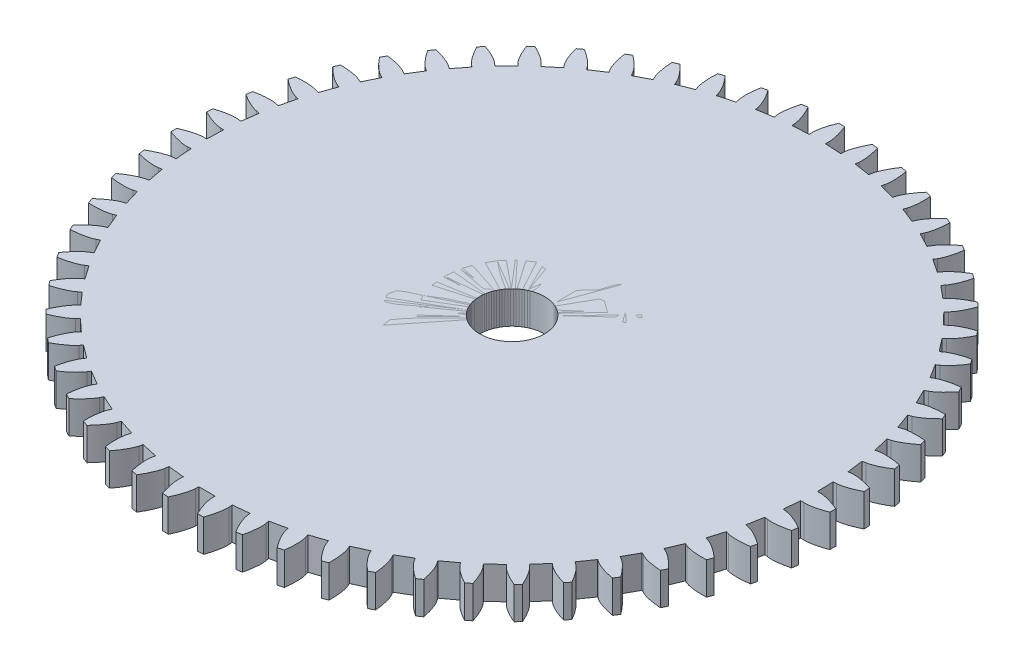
SolidWorks part; units mm, degrees
ref_plane "Front Plane" through (0, 0, 0) normal (0, 0, 1) x (1, 0, 0)
ref_plane "Top Plane" through (0, 0, 0) normal (0, 1, 0) x (1, 0, 0)
ref_plane "Right Plane" through (0, 0, 0) normal (1, 0, 0) x (0, 0, -1)
sketch "Sketch1" plane through (0, 0, 0) normal (0, 1, 0) x (1, 0, 0)
  line L0 (0, 0) -> (0, 14.2802) construction
  line L1 (0, 0) -> (-14.2802, 0) construction
  line L2 (0, 0) -> (-15.2446, -0.406) construction
  line L3 (0, 0) -> (-14.2599, -0.76) construction
  line L4 (0, 0) -> (-14.1993, -1.5179) construction
  circle A0 centre (0, 0) radius 14.75 construction
  circle A1 centre (0, 0) radius 14.2802 construction
  circle A2 centre (0, 0) radius 14.125 construction
  circle A3 centre (0, 0) radius 15.25 construction
  spline S0 degree 4 poles (-14.2802, 0) (-14.2978, 0) (-14.3474, -0.0018) (-14.4406, -0.0124) (-14.5913, -0.0399) (-14.7805, -0.0895) (-15.0205, -0.1702) (-15.2961, -0.2862) (-15.59, -0.435) (-15.8988, -0.619) (-16.1959, -0.8219) (-16.4812, -1.041) (-16.7546, -1.2747) (-17.0723, -1.574) (-17.4337, -1.9569) (-17.8253, -2.4333) (-18.2313, -3.0115) (-18.6013, -3.6289) (-18.9288, -4.2696) (-19.2147, -4.9301) (-19.4294, -5.5215) (-19.5889, -6.0376) (-19.7289, -6.5574) (-19.8297, -6.9976) (-19.9148, -7.4353) (-19.9848, -7.8848) (-20.0314, -8.232) (-20.0699, -8.6068) (-20.098, -8.9343) (-20.1241, -9.4189) (-20.1316, -9.7093) (-20.1356, -10.1755) (-20.1272, -10.3827) (-20.1236, -10.571) (-20.1201, -10.6259) (-20.1186, -10.6664) (-20.1179, -10.6883) knots 0 0 0 0 0 0.005377 0.015084 0.028532 0.04661 0.064855 0.092111 0.119476 0.146842 0.174209 0.201575 0.228941 0.256307 0.307035 0.361767 0.4165 0.471232 0.525964 0.580697 0.635429 0.662795 0.690161 0.744894 0.77226 0.799626 0.826992 0.854358 0.881725 0.909091 0.954545 0.977273 0.988636 0.994318 1 1 1 1 1 construction
  spline S1 degree 4 poles (-14.2802, 0) (-14.2978, 0) (-14.3474, -0.0018) (-14.4406, -0.0124) (-14.5913, -0.0399) (-14.7805, -0.0895) (-15.0205, -0.1702) (-15.2961, -0.2862) (-15.59, -0.435) (-15.8988, -0.619) (-16.1959, -0.8219) (-16.4812, -1.041) (-16.7546, -1.2747) (-17.0723, -1.574) (-17.4337, -1.9569) (-17.8253, -2.4333) (-18.2313, -3.0115) (-18.6013, -3.6289) (-18.9288, -4.2696) (-19.2147, -4.9301) (-19.4294, -5.5215) (-19.5889, -6.0376) (-19.7289, -6.5574) (-19.8297, -6.9976) (-19.9148, -7.4353) (-19.9848, -7.8848) (-20.0314, -8.232) (-20.0699, -8.6068) (-20.098, -8.9343) (-20.1148, -9.2462) (-20.1217, -9.4112) (-20.1244, -9.4929) knots 0 0 0 0 0 0.005377 0.015084 0.028532 0.04661 0.064855 0.092111 0.119476 0.146842 0.174209 0.201575 0.228941 0.256307 0.307035 0.361767 0.4165 0.471232 0.525964 0.580697 0.635429 0.662795 0.690161 0.744894 0.77226 0.799626 0.826992 0.854358 0.881725 0.909091 0.909091 0.909091 0.909091 0.909091
  dimension "D1" = 30.5
  dimension "D2" = 29.5
  dimension "D3" = 28.5604
  dimension "D4" = 28.25
  dimension "D5" = 14.2802
  dimension "D6" = 1.525
  dimension "D7" = 3.051
  dimension "D8" = 6.102
sketch "Sketch2" plane through (0, 0, 0) normal (0, 1, 0) x (1, 0, 0)
  line L0 (0, 0) -> (-15.2446, -0.406) construction
  line L1 (0, 0) -> (-15.2446, -0.406) construction
  line L2 (0, 0) -> (-14.2599, -0.76) construction
  line L3 (0, 0) -> (-14.2802, 0) construction
  line L4 (0, 0) -> (-14.1993, -1.5179) construction
  line L5 (0, 0) -> (-14.2599, -0.76) construction
  line L6 (0, 0) -> (-14.2802, 0) construction
  line L7 (0, 0) -> (-14.1993, -1.5179) construction
  line L8 (-14.2599, -0.76) -> (-14.105, -0.7518)
  line L9 (-14.105, -0.7518) -> (-14.045, -1.5014)
  line L10 (-14.045, -1.5014) -> (-14.1993, -1.5179) construction
  line L11 (-14.045, -1.5014) -> (-1.4915, -0.1594)
  line L12 (-14.2802, 0) -> (-1.5, 0)
  circle A0 centre (0, 0) radius 14.125 construction
  circle A1 centre (0, 0) radius 14.2802 construction
  circle A2 centre (0, 0) radius 14.75 construction
  circle A3 centre (0, 0) radius 15.25 construction
  circle A4 centre (0, 0) radius 14.125 construction
  circle A5 centre (0, 0) radius 14.2802 construction
  circle A6 centre (0, 0) radius 14.75 construction
  circle A7 centre (0, 0) radius 15.25 construction
  arc A8 (-15.2403, -0.5426) -> (-15.2476, -0.2693) centre (0, 0) cw
  circle A11 centre (0, 0) radius 1.5 construction
  arc A12 (-1.5, 0) -> (-1.4915, -0.1594) centre (0, 0) ccw
  spline S0 degree 4 poles (-75.4422, -1998.9074) (-11.2506, -37.7117) (-11.7431, -0.7777) (-13.2367, 0.2067) (-14.5913, -0.0399) (-14.7805, -0.0895) (-15.0205, -0.1702) (-15.2961, -0.2862) (-15.59, -0.435) (-15.8988, -0.619) (-16.1959, -0.8219) (-16.4812, -1.041) (-16.7546, -1.2747) (-17.0723, -1.574) (-17.4337, -1.9569) (-17.8253, -2.4333) (-18.2313, -3.0115) (-18.6013, -3.6289) (-18.9288, -4.2696) (-19.2147, -4.9301) (-19.4294, -5.5215) (-19.5889, -6.0376) (-19.7289, -6.5574) (-19.8297, -6.9976) (-19.9148, -7.4353) (-19.9848, -7.8848) (-20.0314, -8.232) (-20.0699, -8.6068) (-20.2211, -10.368) (-20.1631, -15.141) (-17.7365, 44.6686) (-85.2624, -2008.3105) knots -0.372356 -0.372356 -0.372356 -0.372356 -0.372356 0.005377 0.015084 0.028532 0.04661 0.064855 0.092111 0.119476 0.146842 0.174209 0.201575 0.228941 0.256307 0.307035 0.361767 0.4165 0.471232 0.525964 0.580697 0.635429 0.662795 0.690161 0.744894 0.77226 0.799626 0.826992 0.854358 0.881725 1.388197 1.388197 1.388197 1.388197 1.388197 only from (-14.2802, 0) to (-20.1244, -9.4929) construction
  spline S1 degree 4 poles (-14.2802, 0) (-14.2978, 0) (-14.3474, -0.0018) (-14.4406, -0.0124) (-14.5913, -0.0399) (-14.7805, -0.0895) (-14.973, -0.1542) (-15.1205, -0.2133) (-15.2116, -0.253) (-15.2476, -0.2693) knots 0 0 0 0 0 0.005377 0.015084 0.028532 0.04661 0.064855 0.076878 0.076878 0.076878 0.076878 0.076878
  spline S2 degree 4 poles (-14.2599, -0.76) (-14.2776, -0.761) (-14.3271, -0.7618) (-14.4208, -0.7561) (-14.5728, -0.7368) (-14.7643, -0.6973) (-14.96, -0.6429) (-15.1104, -0.5918) (-15.2035, -0.5569) (-15.2403, -0.5426) knots 0 0 0 0 0 0.005377 0.015084 0.028532 0.04661 0.064855 0.076878 0.076878 0.076878 0.076878 0.076878
  point P21 (-14.105, -0.7518)
  point P24 (-14.045, -1.5014)
  dimension "D2" = 3
extrude "Boss-Extrude1" add sketch "Sketch2" along normal blind 1.5
pattern_circular "CirPattern1" count 59 over 360 of "Boss-Extrude1"
sketch "Sketch3" plane through (0, 0, 0) normal (0, -1, 0) x (1, 0, 0)
  circle A0 centre (9, 0) radius 1
  dimension "D1" = 2
  dimension "D2" = 9
extrude "Boss-Extrude2" add sketch "Sketch3" along normal blind 3
sketch "Sketch4" plane through (0, 0, 0) normal (0, -1, 0) x (1, 0, 0)
  circle A0 centre (9, 0) radius 2
  dimension "D1" = 4
extrude "Boss-Extrude3" add sketch "Sketch4" along normal blind 1.5
equation "\"Module\"= .5"
equation "\"Number of Teeth\"= 59"
equation "\"Pressure Angle\"= 14.5deg"
equation "\"Pitch Diameter\"= \"Number of Teeth\" * \"Module\""
equation "\"Circular Pitch\"= pi * \"Module\""
equation "\"Addendum\"= \"Module\""
equation "\"Dedendum\"= 1.25 * \"Module\""
equation "\"Base Diameter\"= \"Pitch Diameter\" * cos ( \"Pressure Angle\" )"
equation "\"Base Radius\"= \"Base Diameter\" / 2"
equation "\"Width\"= 1.5"
equation "\"Outside Diameter\"= \"Pitch Diameter\" + 2 * \"Addendum\""
equation "\"D1@Sketch1\"=\"Outside Diameter\""
equation "\"D3@Sketch1\"=\"Base Diameter\""
equation "\"Root Diameter\"= \"Pitch Diameter\" - 2 * \"Dedendum\""
equation "\"D4@Sketch1\"=\"Root Diameter\""
equation "\"Tooth Angle\"= 360 / \"Number of Teeth\""
equation "\"D6@Sketch1\"=\"Tooth Angle\"/4"
equation "\"D7@Sketch1\"=\"Tooth Angle\"/2"
equation "\"D8@Sketch1\"=\"Tooth Angle\""
equation "\"D2@Sketch1\" = \"Pitch Diameter\""
equation "\"Shaft Diameter\"= 3"
equation "\"D1@CirPattern1\" = \"Number of Teeth\""
equation "\"D2@Sketch2\"= \"Shaft Diameter\""
equation "\"D1@Boss-Extrude1\" = \"Width\""
